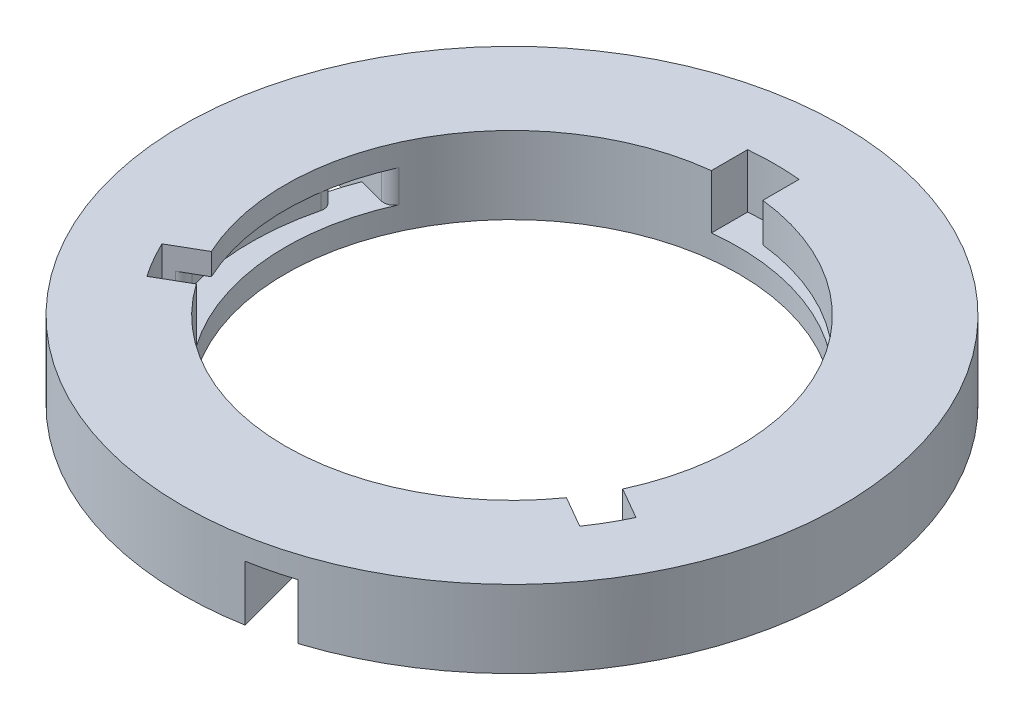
SolidWorks part; units mm, degrees
ref_plane "Plan de face" through (0, 0, 0) normal (0, 0, 1) x (1, 0, 0)
ref_plane "Plan de dessus" through (0, 0, 0) normal (0, 1, 0) x (1, 0, 0)
ref_plane "Plan de droite" through (0, 0, 0) normal (1, 0, 0) x (0, 0, -1)
sketch "Esquisse2" plane through (0, 0, 0) normal (0, 0, 1) x (1, 0, 0)
  line L0 (0, 40.3076) -> (0, -38.1147) construction
  line L1 (44, 0) -> (64, 0)
  line L2 (44, 0) -> (44, 15)
  line L3 (44, 15) -> (64, 15)
  line L4 (64, 0) -> (64, 15)
  dimension "D1" = 15
  dimension "D2" = 20
  dimension "D3" = 44
revolve "Révolution3" add sketch "Esquisse2" angle 360 about L0
sketch "Esquisse4" plane through (0, 15, 0) normal (0, 1, 0) x (1, 0, 0)
  line L0 (5, 50.7543) -> (5, 43.715)
  line L1 (-5, 50.7543) -> (-5, 43.715)
  arc A0 (5, 50.7543) -> (-5, 50.7543) centre (0, 0) ccw
  circle A1 centre (0, 0) radius 44 construction
  arc A2 (5, 43.715) -> (-5, 43.715) centre (0, 0) ccw
  dimension "D1" = 102
  dimension "D2" = 5
  dimension "D3" = 10
extrude "Enlèv. mat.-Extru.1" cut sketch "Esquisse4" against normal blind 10.5
sketch "Esquisse5" plane through (0, 15, 0) normal (0, 1, 0) x (1, 0, 0)
  line L0 (-46.0312, -21.9573) -> (-39.9473, -18.4448)
  line L1 (-42.0312, -28.8855) -> (-35.9473, -25.373)
  line L2 (-8.25, 0) -> (8.25, 0) construction
  arc A0 (-46.0312, -21.9573) -> (-42.0312, -28.8855) centre (0, 0) ccw
  arc A1 (-5, 43.715) -> (5, 43.715) centre (0, 0) ccw construction
  arc A2 (-39.9473, -18.4448) -> (-35.9473, -25.373) centre (0, 0) ccw
  dimension "D1" = 102
  dimension "D2" = 8
  dimension "D3" = 4
  dimension "D4" = 30
extrude "Enlèv. mat.-Extru.2" cut sketch "Esquisse5" against normal blind 10.5
pattern_circular "Répétition circulaire1" count 2 every 120 about axis through (0, 0, 0) along (0, 1, 0) of "Enlèv. mat.-Extru.2"
sketch "Esquisse13" plane through (0, 4.5, 0) normal (0, 1, 0) x (1, 0, 0)
  line L1 (0, 0) -> (57.2833, 57.2833) construction
  line L3 (0, -8.25) -> (0, 8.25) construction
  line L4 (36.251, 24.9373) -> (41.2729, 29.9592)
  line L5 (5, 43.715) -> (5, 50.7543) construction
  line L6 (5, 43.715) -> (5, 50.7543)
  arc A0 (5, 50.7543) -> (41.2729, 29.9592) centre (0, 0) cw
  arc A1 (39.9473, -18.4448) -> (5, 43.715) centre (0, 0) ccw construction
  arc A2 (36.251, 24.9373) -> (5, 43.715) centre (0, 0) ccw
  dimension "D1" = 45
  dimension "D2" = 8
extrude "Enlèv. mat.-Extru.5" cut sketch "Esquisse13" along normal blind 3
sketch "Esquisse18" plane through (0, 4.5, 0) normal (0, 1, 0) x (1, 0, 0)
  line L0 (0, 0) -> (44.1673, -25.5) construction
  line L1 (0, 0) -> (15.9845, -59.655) construction
  line L2 (5.9861, -43.5909) -> (7.8102, -50.3984)
  line L3 (35.9473, -25.373) -> (42.0312, -28.8855) construction
  line L4 (35.9473, -25.373) -> (42.0312, -28.8855)
  arc A0 (42.0312, -28.8855) -> (46.0312, -21.9573) centre (0, 0) ccw construction
  arc A1 (42.0312, -28.8855) -> (7.8102, -50.3984) centre (0, 0) cw
  arc A2 (-35.9473, -25.373) -> (35.9473, -25.373) centre (0, 0) ccw construction
  arc A3 (5.9861, -43.5909) -> (35.9473, -25.373) centre (0, 0) ccw
  dimension "D1" = 45
  dimension "D2" = 5.5
extrude "Enlèv. mat.-Extru.7" cut sketch "Esquisse18" along normal blind 3
sketch "Esquisse20" plane through (0, 7.5, 0) normal (0, 1, 0) x (1, 0, 0)
  line L0 (-19.4396, 6.6047) -> (56.8822, -37.4597) construction
  line L1 (46.0312, -21.9573) -> (39.9473, -18.4448) construction
  line L2 (38.9784, -27.123) -> (35.9473, -25.373)
  line L3 (9.7151, -24.666) -> (22.6557, -72.9612) construction
  line L4 (5.9861, -43.5909) -> (7.8102, -50.3984) construction
  arc A0 (14.2593, -41.6254) -> (38.9784, -27.123) centre (2.3788, 6.9427) ccw
  arc A1 (14.2593, -41.6254) -> (35.9473, -25.373) centre (0, 0) ccw
  arc A3 (5.9861, -43.5909) -> (39.9473, -18.4448) centre (0, 0) ccw construction
  point P15 (14.2593, -41.6254)
  dimension "D4" = 100
  dimension "D1" = 8
  dimension "D2" = 3.5
  dimension "D3" = 8.5
extrude "Enlèv. mat.-Extru.8" cut sketch "Esquisse20" along normal blind 3.25
sketch "Esquisse21" plane through (0, 7.5, 0) normal (0, -1, 0) x (1, 0, 0)
  line L0 (5.9861, 43.5909) -> (7.8102, 50.3984) construction
  line L1 (5.9861, 43.5909) -> (7.8102, 50.3984)
  line L2 (14.2593, 41.6254) -> (16.0747, 48.4005)
  arc A0 (42.0312, 28.8855) -> (7.8102, 50.3984) centre (0, 0) ccw construction
  arc A1 (16.0747, 48.4005) -> (7.8102, 50.3984) centre (0, 0) ccw
  arc A2 (14.2593, 41.6254) -> (5.9861, 43.5909) centre (0, 0) ccw construction
  arc A3 (14.2593, 41.6254) -> (5.9861, 43.5909) centre (0, 0) ccw
extrude "Enlèv. mat.-Extru.9" cut sketch "Esquisse21" against normal blind 3.25
pattern_circular "Répétition circulaire3" count 2 every 120 about axis through (0, 0, 0) along (0, 1, 0) of "Enlèv. mat.-Extru.7", "Enlèv. mat.-Extru.8", "Enlèv. mat.-Extru.9"
fillet "Congé1" radius 2 6 edges at (38.9784, 9.125, 27.123) (-43.1783, 9.125, -8.4638) (-42.9784, 9.125, 20.1948) (14.2593, 9.125, 41.6254) (-40.7439, 7.625, -16.6113) (5.9861, 7.625, 43.5909)
sketch "Esquisse23" plane through (0, 10.75, 0) normal (0, -1, 0) x (1, 0, 0)
  line L0 (7.8102, 50.3984) -> (11.1905, 63.0141)
  line L1 (7.8102, 50.3984) -> (6.4338, 45.2615) construction
  line L2 (19.444, 60.9748) -> (16.0747, 48.4005)
  arc A0 (16.0747, 48.4005) -> (7.8102, 50.3984) centre (0, 0) ccw construction
  arc A1 (16.0747, 48.4005) -> (7.8102, 50.3984) centre (0, 0) ccw
  circle A2 centre (0, 0) radius 64 construction
  arc A3 (19.444, 60.9748) -> (11.1905, 63.0141) centre (0, 0) ccw
extrude "Enlèv. mat.-Extru.10" cut sketch "Esquisse23" along normal up to next
pattern_circular "Répétition circulaire4" count 2 every 120 about axis through (0, 40.3076, 0) along (0, 1, 0) of "Enlèv. mat.-Extru.10"
